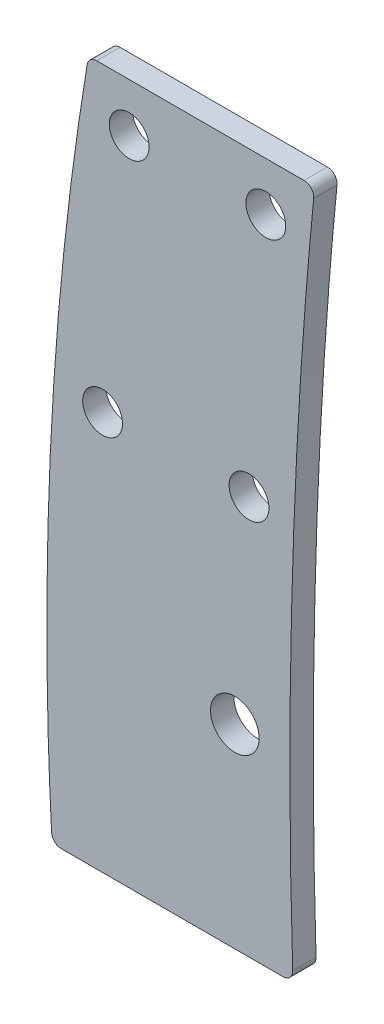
SolidWorks part; units mm, degrees
ref_plane "Plan de face" through (0, 0, 0) normal (0, 0, 1) x (1, 0, 0)
ref_plane "Plan de dessus" through (0, 0, 0) normal (0, 1, 0) x (1, 0, 0)
ref_plane "Plan de droite" through (0, 0, 0) normal (1, 0, 0) x (0, 0, -1)
sketch "Esquisse1" plane through (0, 0, 0) normal (0, 0, 1) x (1, 0, 0)
  line L0 (-0.7395, 9.26) -> (-0.7395, 0)
  line L1 (-0.7395, 0) -> (-8.7395, 0)
  line L2 (-11.212, -0.3463) -> (-15.725, -1.6357)
  line L3 (-0.7395, 13.66) -> (-19.6827, 8.2476)
  line L4 (89.2605, -120.251) -> (-60.7622, -160.4495) construction
  line L5 (89.2605, -120.251) -> (-87.485, -120.251) construction
  line L6 (-86.1521, -200) -> (170.4283, -200) construction
  line L7 (89.2605, -183.0726) -> (89.2605, -200) construction
  line L8 (-0.7395, 13.66) -> (38.0779, 22.1236)
  line L9 (-0.7395, 13.66) -> (-0.7395, 74.26) construction
  line L10 (89.2605, -200) -> (89.2605, -216.9274) construction
  line L11 (101.2572, -177.7054) -> (109.2605, -207.5742)
  arc A2 (-8.7395, 0) -> (-11.212, -0.3463) centre (-8.7395, -9) ccw
  arc A8 (-0.7395, 9.26) -> (38.0779, 22.1236) centre (-0.7395, 74.26) ccw
  ellipse E0 centre (-14.2395, -121.4237) end of major axis (-14.2395, -1.4237) minor radius 25 (-15.725, -1.6357) -> (-34.1467, -194.014) ccw
  ellipse E1 centre (-14.2395, -121.4237) end of major axis (-14.2395, 9.0229) minor radius 50 (-19.6827, 8.2476) -> (-52.4262, -205.6311) ccw
  ellipse E3 centre (45.7938, -131.8979) end of major axis (-80.047, -165.6168) minor radius 94.5 (-52.4262, -205.6311) -> (109.2605, -207.5742) ccw
  ellipse E4 centre (45.7938, -131.8979) end of major axis (161.7049, -100.8396) minor radius 62.5 (-34.1467, -194.014) -> (101.2572, -177.7054) ccw
  point P15 (-10, 0)
  dimension "D3" = 240
  dimension "D9" = 65
  dimension "D10" = 60.6
  dimension "D13" = 13.5
  dimension "D14" = 15
  dimension "D15" = 125
  dimension "D16" = 9
  dimension "D19" = 200
  dimension "D18" = 260.56
  dimension "D4" = 90
  dimension "D5" = 32
  dimension "D6" = 13.66
  dimension "D7" = 8
  dimension "D8" = 102.3
  dimension "D11" = 50
  dimension "D12" = 25
  dimension "D17" = 240
  dimension "D20" = 45
  dimension "D21" = 20
extrude "Boss.-Extru.1" add sketch "Esquisse1" along normal blind 2.3
fillet "Congé1" radius 3.2 1 edges at (-0.7395, 9.26, 1.15)
fillet "Congé2" radius 0.8 1 edges at (38.0779, 22.1236, 1.15)
sketch "Esquisse6" plane through (0, 0, 2.3) normal (0, 0, 1) x (1, 0, 0)
  line L0 (34.166, 21.2706) -> (-0.7395, 13.66) construction
  circle A0 centre (13.8526, 13.8888) radius 1.5
  arc A1 (34.7735, 19.8189) -> (34.166, 21.2706) centre (34.3364, 20.489) ccw construction
  dimension "D1" = 3
  dimension "D3" = 21.5209
  dimension "D2" = 2.8851
extrude "Enlèv. mat.-Extru.2" cut sketch "Esquisse6" against normal blind 4
fillet "Congé4" radius 40 1 edges at (-34.1467, -194.014, 1.15)
fillet "Congé5" radius 55 1 edges at (-52.4262, -205.6311, 1.15)
fillet "Congé6" radius 5 2 edges at (109.2605, -207.5742, 1.15) (101.2572, -177.7054, 1.15)
sketch "Esquisse7" plane through (0, 0, 2.3) normal (0, 0, 1) x (1, 0, 0)
  line L0 (-144.8031, -104.5541) -> (34.7735, -104.5541) construction
  line L1 (34.7735, 19.8189) -> (34.7735, -228.9271) construction
  line L2 (-63.6989, -140.5541) -> (-38.9198, -140.5541)
  line L3 (-36.6823, -68.5541) -> (-59.9488, -68.5541)
  arc A0 (34.7735, 19.8189) -> (34.166, 21.2706) centre (34.3364, 20.489) ccw construction
  arc A1 (2.3104, 9.3316) -> (34.7735, 19.8189) centre (-0.7395, 74.26) ccw construction
  ellipse E0 centre (45.7938, -131.8979) end of major axis (-80.047, -165.6168) minor radius 94.5 (-23.5509, -221.1552) -> (105.7042, -209.472) ccw construction
  ellipse E1 centre (-14.2395, -121.4237) end of major axis (-14.2395, -241.4237) minor radius 25 (-15.725, -1.6357) -> (-37.7106, -162.7454) ccw construction
  ellipse E2 centre (-14.2395, -121.4237) end of major axis (-14.2395, -241.4237) minor radius 25 (-36.6823, -68.5541) -> (-38.9198, -140.5541) ccw
  ellipse E3 centre (-14.2395, -121.4237) end of major axis (-14.2395, 9.0229) minor radius 50 (-19.6827, 8.2476) -> (-58.9636, -179.7467) ccw construction
  ellipse E4 centre (-14.2395, -121.4237) end of major axis (-14.2395, 9.0229) minor radius 50 (-59.9488, -68.5541) -> (-63.6989, -140.5541) ccw
  dimension "D1" = 36
  dimension "D2" = 72
extrude "Enlèv. mat.-Extru.3" cut sketch "Esquisse7" against normal through all flip side to cut
fillet "Congé7" radius 1 4 edges
sketch "Esquisse8" plane through (0, 0, 2.3) normal (0, 0, 1) x (1, 0, 0)
  line L2 (-62.7528, -140.5541) -> (-39.953, -140.5541)
  line L3 (-37.7883, -68.5541) -> (-59.103, -68.5541)
  line L4 (-62.7528, -140.5541) -> (-39.953, -140.5541)
  line L5 (-37.7883, -68.5541) -> (-59.103, -68.5541)
  arc A4 (-63.7513, -139.608) -> (-62.7528, -140.5541) centre (-62.7528, -139.5541) ccw
  arc A5 (-39.953, -140.5541) -> (-38.9535, -139.5223) centre (-39.953, -139.5541) ccw
  arc A6 (-36.7933, -69.6532) -> (-37.7883, -68.5541) centre (-37.7883, -69.5541) ccw
  arc A7 (-59.103, -68.5541) -> (-60.0894, -69.3896) centre (-59.103, -69.5541) ccw
  arc A8 (-63.7513, -139.608) -> (-62.7528, -140.5541) centre (-62.7528, -139.5541) ccw
  arc A9 (-39.953, -140.5541) -> (-38.9535, -139.5223) centre (-39.953, -139.5541) ccw
  arc A10 (-36.7933, -69.6532) -> (-37.7883, -68.5541) centre (-37.7883, -69.5541) ccw
  arc A11 (-59.103, -68.5541) -> (-60.0894, -69.3896) centre (-59.103, -69.5541) ccw
  ellipse E2 centre (-14.2395, -121.4237) end of major axis (-14.2395, 9.0229) minor radius 50 (-60.0894, -69.3896) -> (-63.7513, -139.608) ccw
  ellipse E3 centre (-14.2395, -121.4237) end of major axis (-14.2395, -241.4237) minor radius 25 (-36.7933, -69.6532) -> (-38.9535, -139.5223) ccw
  ellipse E4 centre (-14.2395, -121.4237) end of major axis (-14.2395, 9.0229) minor radius 50 (-60.0894, -69.3896) -> (-63.7513, -139.608) ccw
  ellipse E5 centre (-14.2395, -121.4237) end of major axis (-14.2395, -241.4237) minor radius 25 (-36.7933, -69.6532) -> (-38.9535, -139.5223) ccw
  dimension "D1" = 0
extrude "Boss.-Extru.2" add sketch "Esquisse8" along normal blind 0.1
hole_wizard "Diamètre du perçage Ø5.0 (5)1" positions "Esquisse10" profile "Esquisse9" hole size "Ø5.0" standard "ISO"
sketch "Esquisse10" plane through (0, 0, 2.4) normal (0, 0, 1) x (1, 0, 0)
  line L0 (-63.8196, -104.5541) -> (-38.9912, -104.5541) construction
  line L2 (-62.7528, -140.5541) -> (-39.953, -140.5541) construction
  line L3 (-51.4054, -104.5541) -> (-51.4054, -133.2113) construction
  ellipse E0 centre (-14.2395, -121.4237) end of major axis (-14.2395, 9.0229) minor radius 50 (-60.0894, -69.3896) -> (-63.7513, -139.608) ccw construction
  ellipse E1 centre (-14.2395, -121.4237) end of major axis (-14.2395, -241.4237) minor radius 25 (-36.7933, -69.6532) -> (-38.9535, -139.5223) ccw construction
  point P0 (-44.9054, -120.5541)
  dimension "D1" = 36
  dimension "D2" = 16
  dimension "D3" = 6.5
sketch "Esquisse9" plane through (-44.9054, -120.5541, 2.4) normal (1, 0, 0) x (0, -1, 0)
  line L0 (0, 0) -> (0, 61.5022)
  line L1 (0, 61.5022) -> (2.5, 60)
  line L2 (2.5, 60) -> (2.5, 0)
  line L5 (2.5, 0) -> (0, 0)
  line L10 (0, 61.5022) -> (-2.5, 60) construction
  line L11 (0, -6.35) -> (0, 107.95) construction
  dimension "Diamètre du perçage" = 5
  dimension "Profondeur du perçage" = 60
  dimension "Angle de pointe" = 118
hole_wizard "Diamètre du perçage Ø4.1 (4.1)1" positions "Esquisse12" profile "Esquisse11" hole size "Ø4.1" standard "ISO"
sketch "Esquisse12" plane through (0, 0, 2.4) normal (0, 0, 1) x (1, 0, 0)
  line L0 (-55.7704, -73.5541) -> (-41.719, -73.5541) construction
  line L3 (-43.4487, -99.5541) -> (-58.5039, -99.5541) construction
  line L6 (-63.8196, -104.5541) -> (-38.9912, -104.5541) construction
  line L8 (-62.7528, -140.5541) -> (-39.953, -140.5541) construction
  line L9 (-37.7883, -68.5541) -> (-59.103, -68.5541) construction
  line L10 (-51.4054, -104.5541) -> (-48.3155, -68.5541) construction
  line L11 (-36.6823, -68.5541) -> (-59.9488, -68.5541) construction
  ellipse E0 centre (-14.2395, -121.4237) end of major axis (-14.2395, 9.0229) minor radius 50 (-60.0894, -69.3896) -> (-63.7513, -139.608) ccw construction
  ellipse E1 centre (-14.2395, -121.4237) end of major axis (-14.2395, -241.4237) minor radius 25 (-36.7933, -69.6532) -> (-38.9535, -139.5223) ccw construction
  ellipse E2 centre (-14.2395, -121.4237) end of major axis (-14.2395, 9.0229) minor radius 50 (-59.1327, -63.9915) -> (-63.7513, -139.608) ccw construction
  ellipse E3 centre (-14.2395, -121.4237) end of major axis (-14.2395, -241.4237) minor radius 25 (-36.1903, -63.9913) -> (-38.9535, -139.5223) ccw construction
  point P0 (-55.7704, -73.5541)
  point P1 (-41.719, -73.5541)
  point P3 (-43.4487, -99.5541)
  point P5 (-58.5039, -99.5541)
  dimension "D1" = 36
  dimension "D2" = 5
  dimension "D3" = 5
  dimension "D4" = 7
  dimension "D5" = 7
  dimension "D6" = 7.5
  dimension "D7" = 7.5
sketch "Esquisse11" plane through (-55.7704, -73.5541, 2.4) normal (1, 0, 0) x (0, -1, 0)
  line L0 (0, 0) -> (0, 61.2318)
  line L1 (0, 61.2318) -> (2.05, 60)
  line L2 (2.05, 60) -> (2.05, 0)
  line L5 (2.05, 0) -> (0, 0)
  line L10 (0, 61.2318) -> (-2.05, 60) construction
  line L11 (0, -6.35) -> (0, 107.95) construction
  dimension "Diamètre du perçage" = 4.1
  dimension "Profondeur du perçage" = 60
  dimension "Angle de pointe" = 118
